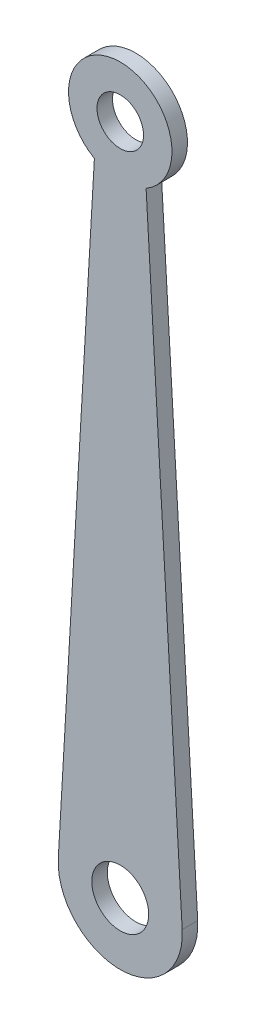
SolidWorks part; units mm, degrees
ref_plane "Front" through (0, 0, 0) normal (0, 0, 1) x (1, 0, 0)
ref_plane "Top" through (0, 0, 0) normal (0, 1, 0) x (1, 0, 0)
ref_plane "Right" through (0, 0, 0) normal (1, 0, 0) x (0, 0, -1)
sketch "Sketch1" plane through (0, 0, 0) normal (0, 0, 1) x (1, 0, 0)
  line L3 (-2.5, 60.6699) -> (-5.99, 0.3465)
  line L4 (2.5, 60.6699) -> (5.99, 0.3465)
  circle A0 centre (0, 65) radius 2.25
  arc A1 (2.5, 60.6699) -> (-2.5, 60.6699) centre (0, 65) ccw
  circle A2 centre (0, 0) radius 2.75
  arc A3 (-5.99, 0.3465) -> (5.99, 0.3465) centre (0, 0) ccw
extrude "Extrude1" add sketch "Sketch1" along normal blind 1.5
